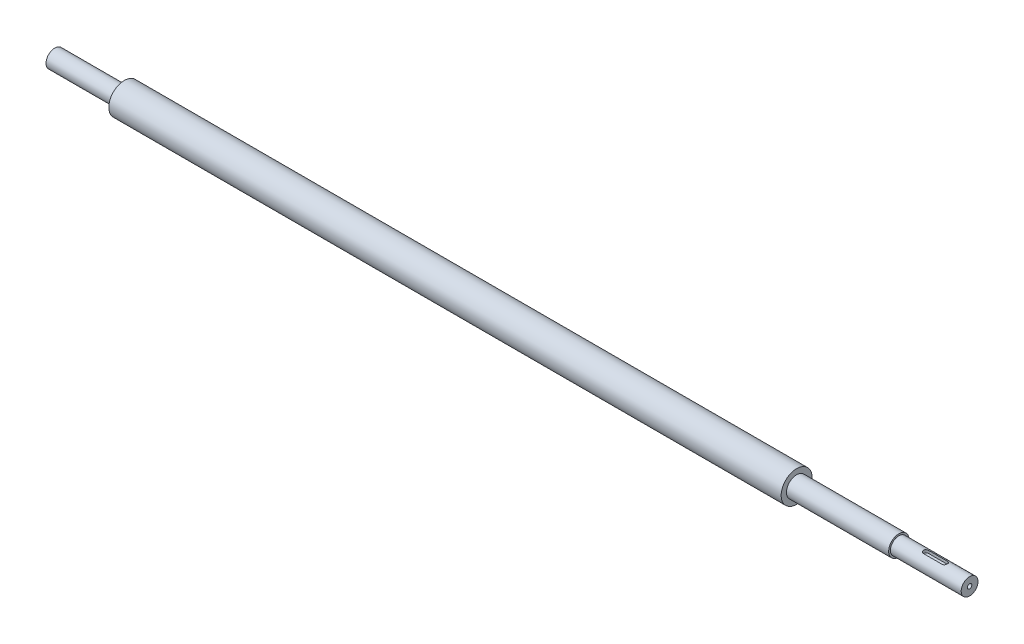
SolidWorks part; units mm, degrees
ref_plane "Plan de face" through (0, 0, 0) normal (0, 0, 1) x (1, 0, 0)
ref_plane "Plan de dessus" through (0, 0, 0) normal (0, 1, 0) x (1, 0, 0)
ref_plane "Plan de droite" through (0, 0, 0) normal (1, 0, 0) x (0, 0, -1)
sketch "Esquisse1" plane through (0, 0, 0) normal (0, 0, 1) x (1, 0, 0)
  line L0 (-517, 0) -> (-517, 10)
  line L1 (-517, 10) -> (-438.5, 10)
  line L2 (-438.5, 10) -> (-438.5, 17.5)
  line L3 (-438.5, 17.5) -> (321.5, 17.5)
  line L4 (321.5, 17.5) -> (321.5, 11.5)
  line L5 (321.5, 11.5) -> (437, 11.5)
  line L6 (517, 9.5) -> (517, 0)
  line L7 (517, 0) -> (-517, 0)
  line L8 (-517, 0) -> (-549.1018, 0) construction
  line L9 (437, 11.5) -> (437, 9.5)
  line L10 (437, 9.5) -> (517, 9.5)
  dimension "D1" = 1034
  dimension "D2" = 760
  dimension "D3" = 80
  dimension "D4" = 20
  dimension "D5" = 35
  dimension "D6" = 115.5
  dimension "D7" = 23
  dimension "D8" = 19
revolve "Révolution1" add sketch "Esquisse1" angle 360 about L8
hole_wizard "Trou taraudé M6x1.01" positions "Esquisse3" profile "Esquisse2" tap size "M6x1.0" standard "ISO"
sketch "Esquisse3" plane through (517, 0, 0) normal (1, 0, 0) x (0, 0, -1)
  point P0 (0, 0)
sketch "Esquisse2" plane through (517, 0, 0) normal (0, 1, 0) x (0, 0, -1)
  line L0 (0, 0) -> (0, 19.5022)
  line L1 (0, 19.5022) -> (2.5, 18)
  line L2 (2.5, 18) -> (2.5, 0)
  line L5 (2.5, 0) -> (0, 0)
  line L10 (0, 19.5022) -> (-2.5, 18) construction
  line L11 (0, -6.35) -> (0, 107.95) construction
  dimension "Diamètre du trou pour taraudage" = 5
  dimension "Profondeur du trou pour taraudage" = 18
  dimension "Angle de pointe" = 118
sketch "Esquisse21" plane through (517, -21.3067, 5.993) normal (1, 0, 0) x (0, 0, -1)
  line L0 (5.993, 27.8067) -> (5.993, 30.8067)
  line L1 (5.993, 30.8067) -> (15.993, 30.8067)
  circle A0 centre (5.993, 21.3067) radius 9.5 construction
  dimension "D1" = 3
  dimension "D2" = 10
ref_plane "Plan1" through (517, 9.5, 0) normal (0, 1, 0) x (1, 0, 0)
sketch "Esquisse11" plane through (517, 9.5, 0) normal (0, 1, 0) x (0, 0, 1)
  line L0 (-3, -28) -> (-3, -49)
  line L1 (3, -49) -> (3, -28)
  line L2 (0, 0) -> (-10, 0) construction
  arc A0 (-3, -49) -> (3, -49) centre (0, -49) ccw
  arc A1 (3, -28) -> (-3, -28) centre (0, -28) ccw
  dimension "D1" = 21
  dimension "D2" = 6
  dimension "D3" = 28
extrude "Enlèv. mat.-Extru.2" cut sketch "Esquisse11" against normal blind 3.5
other "rainure clavette 1"
